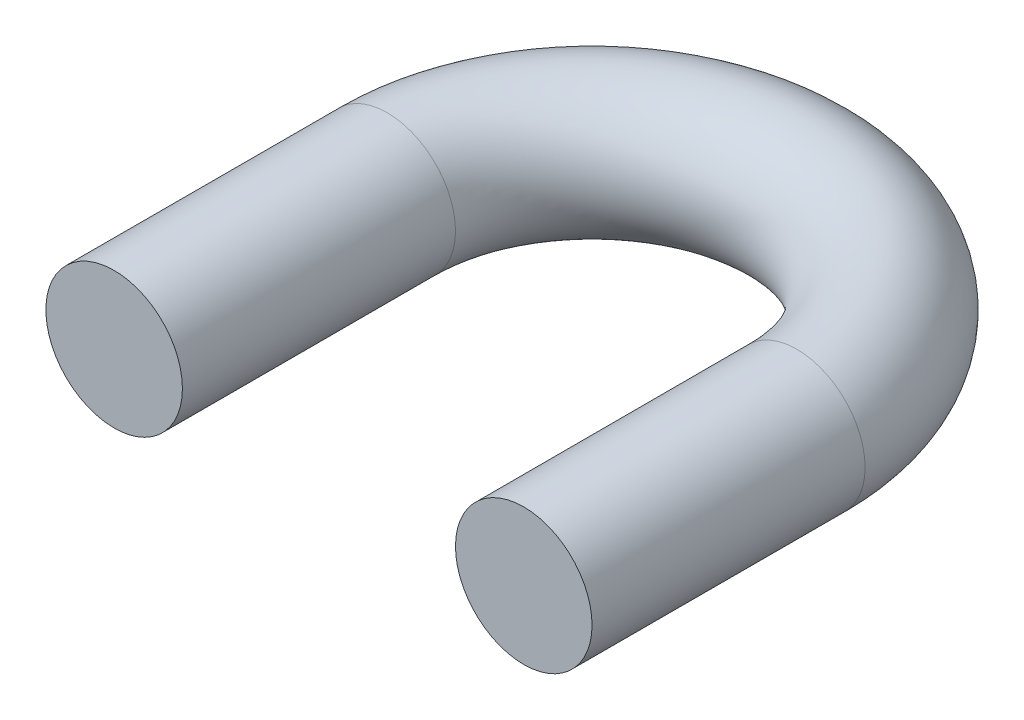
SolidWorks part; units mm, degrees
ref_plane "FRONT" through (0, 0, 0) normal (0, 0, 1) x (1, 0, 0)
ref_plane "TOP" through (0, 0, 0) normal (0, 1, 0) x (1, 0, 0)
ref_plane "RIGHT" through (0, 0, 0) normal (1, 0, 0) x (0, 0, -1)
sketch "Sketch1" plane through (0, 0, 0) normal (0, 1, 0) x (1, 0, 0)
  line L0 (4.7625, 0) -> (4.7625, -9.525)
  line L1 (-9.525, -9.525) -> (-9.525, 0) construction
  line L2 (-4.7625, -9.525) -> (-4.7625, 0)
  line L3 (9.525, 0) -> (9.525, -9.525) construction
  arc A0 (4.7625, 0) -> (-4.7625, 0) centre (0, 0) ccw
  arc A1 (9.525, 0) -> (-9.525, 0) centre (0, 0) ccw construction
  dimension "D2" = 19.05
  dimension "D3" = 19.05
ref_plane "Plane1" through (0, 0, 9.525) normal (0, 0, 1) x (1, 0, 0)
sketch "Sketch2" plane through (0, 0, 9.525) normal (0, 0, 1) x (1, 0, 0)
  line L0 (4.7625, 0) -> (-4.7625, 0) construction
  line L1 (10.4775, 0) -> (-10.4775, 0) construction
  line L2 (9.525, 0) -> (-9.525, 0) construction
  circle A0 centre (-7.1438, 0) radius 2.3813
sweep "Sweep1" add profiles "Sketch2" path "Sketch1"
ref_point "FOR ASSY" parameters "D1"=7.4809
